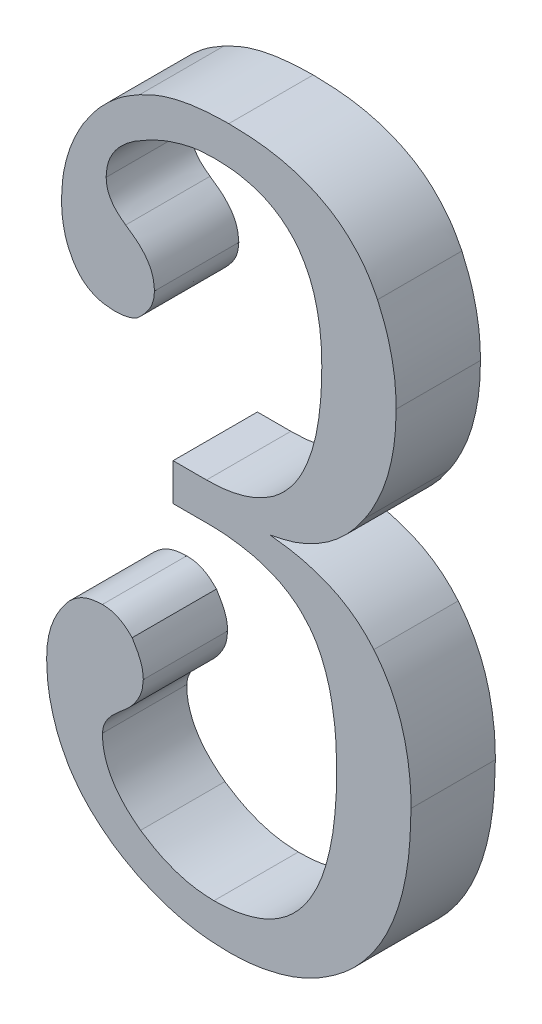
SolidWorks part; units mm, degrees
ref_plane "前基準面" through (0, 0, 0) normal (0, 0, 1) x (1, 0, 0)
ref_plane "上基準面" through (0, 0, 0) normal (0, 1, 0) x (1, 0, 0)
ref_plane "右基準面" through (0, 0, 0) normal (1, 0, 0) x (0, 0, -1)
sketch "草圖1" plane through (0, 0, 0) normal (0, 0, 1) x (1, 0, 0)
  text T0 "3" font "標楷體" height 25
extrude "填料-伸長1" add sketch "草圖1" along normal blind 3
